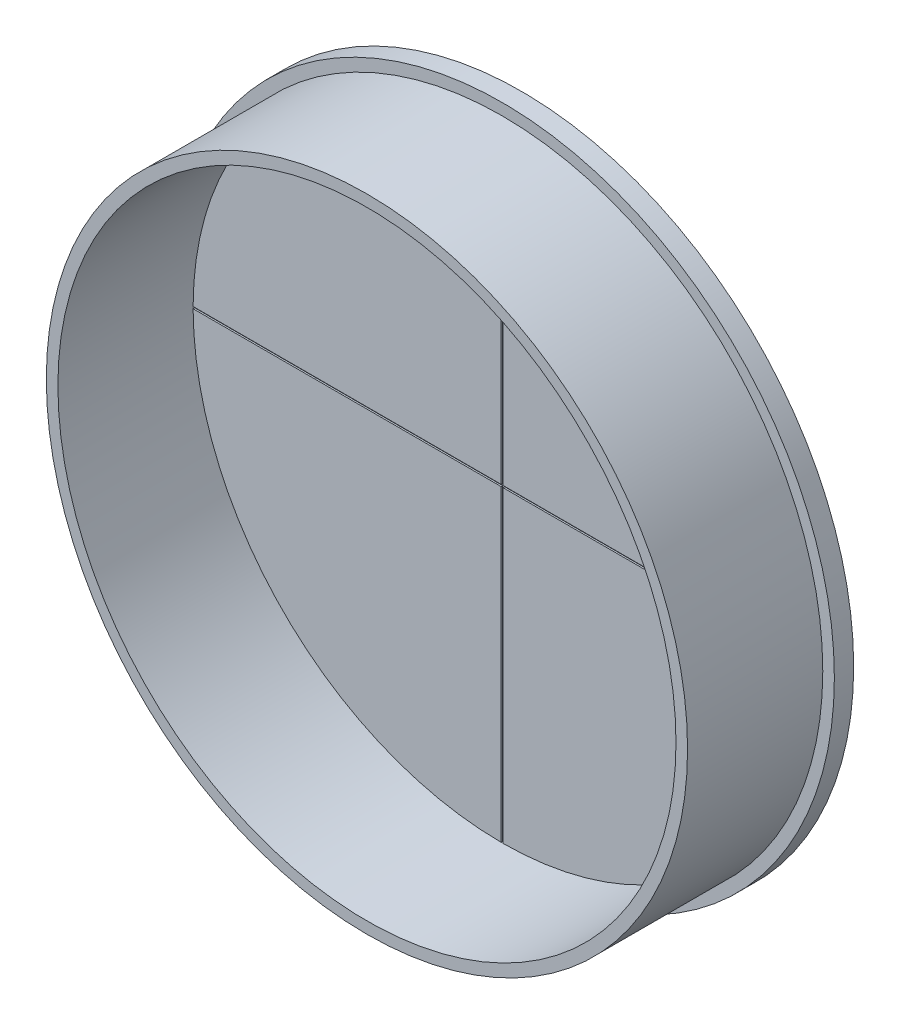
SolidWorks part; units mm, degrees
ref_plane "Front Plane" through (0, 0, 0) normal (0, 0, 1) x (1, 0, 0)
ref_plane "Top Plane" through (0, 0, 0) normal (0, 1, 0) x (1, 0, 0)
ref_plane "Right Plane" through (0, 0, 0) normal (1, 0, 0) x (0, 0, -1)
sketch "Sketch1" plane through (0, 0, 0) normal (0, 0, 1) x (1, 0, 0)
  circle A0 centre (0, 0) radius 86
  dimension "D1" = 172
extrude "Boss-Extrude1" add sketch "Sketch1" along normal blind 5
sketch "Sketch2" plane through (0, 0, 5) normal (0, 0, 1) x (1, 0, 0)
  circle A0 centre (0, 0) radius 83
  circle A1 centre (0, 0) radius 80
  circle A2 centre (0, 0) radius 86 construction
extrude "Boss-Extrude2" add sketch "Sketch2" along normal blind 35
sketch "Sketch3" plane through (0, 0, 5) normal (0, 0, 1) x (1, 0, 0)
  line L0 (0.25, 0.25) -> (79.9996, 0.25)
  line L1 (-79.9996, -0.25) -> (-0.25, -0.25)
  line L2 (-79.9996, -0.25) -> (-79.9996, 0.25)
  line L3 (-79.9996, 0.25) -> (-0.25, 0.25)
  line L4 (79.9996, -0.25) -> (79.9996, 0.25)
  line L5 (-79.9996, -0.25) -> (79.9996, 0.25) construction
  line L6 (-79.9996, 0.25) -> (79.9996, -0.25) construction
  line L7 (-0.25, -79.9996) -> (0.25, -79.9996)
  line L8 (-0.25, -79.9996) -> (-0.25, -0.25)
  line L9 (-0.25, 79.9996) -> (0.25, 79.9996)
  line L10 (0.25, -79.9996) -> (0.25, -0.25)
  line L11 (-0.25, -79.9996) -> (0.25, 79.9996) construction
  line L12 (-0.25, 79.9996) -> (0.25, -79.9996) construction
  line L13 (0.25, -0.25) -> (79.9996, -0.25)
  line L14 (-0.25, 0.25) -> (-0.25, 79.9996)
  line L15 (0.25, 0.25) -> (0.25, 79.9996)
  circle A0 centre (0, 0) radius 80 construction
  circle A1 centre (0, 0) radius 80 construction
  point P0 (0, 0)
  point P8 (0, 0)
  dimension "D1" = 0.5
  dimension "D2" = 0.5
extrude "Cut-Extrude1" cut sketch "Sketch3" against normal blind 0.4
